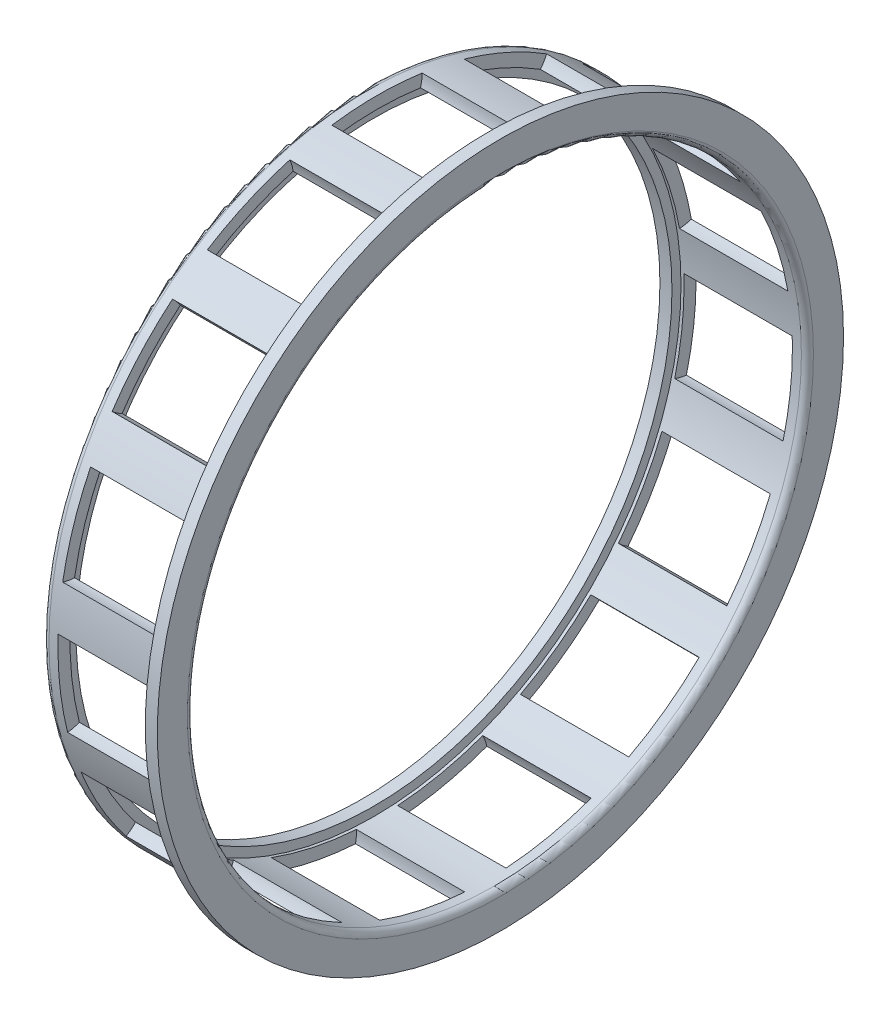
SolidWorks part; units mm, degrees
ref_plane "Plane1" through (0, 0, 0) normal (0, 0, 1) x (1, 0, 0)
ref_plane "Plane2" through (0, 0, 0) normal (0, 1, 0) x (1, 0, 0)
ref_plane "Plane3" through (0, 0, 0) normal (1, 0, 0) x (0, 0, -1)
sketch "Esquisse1" plane through (0, 0, 0) normal (0, 0, 1) x (1, 0, 0)
  line L0 (0, 10.6) -> (4.2, 10.6)
  line L1 (0, 10.6) -> (0, 9.9)
  line L2 (4.2, 10.6) -> (4.2, 11.4)
  line L3 (-3, 0) -> (10.3, 0) construction
  dimension "D1" = 4.2
revolve "Base-Révol.-Mince" add sketch "Esquisse1" angle 360 about L3
fillet "Congé1" radius 0.2
sketch "Esquisse3" plane through (0, 0, 0) normal (0, 0, 1) x (1, 0, 0)
  line L0 (4.1, 10.5) -> (0.5, 10.5)
  line L1 (4.1, 10.5) -> (4.1, 12)
  line L2 (0.5, 12) -> (4.1, 12)
  line L3 (0.5, 12) -> (0.5, 10.5)
  line L4 (-0.3, 10.5) -> (5.1, 10.5) construction
revolve "Enlever de la matière-Pivoter1" cut sketch "Esquisse3" angle 360 about L4
pattern_circular "Répétition circulaire1" count 15 every 24 about axis through (-3, 0, 0) along (1, 0, 0)
